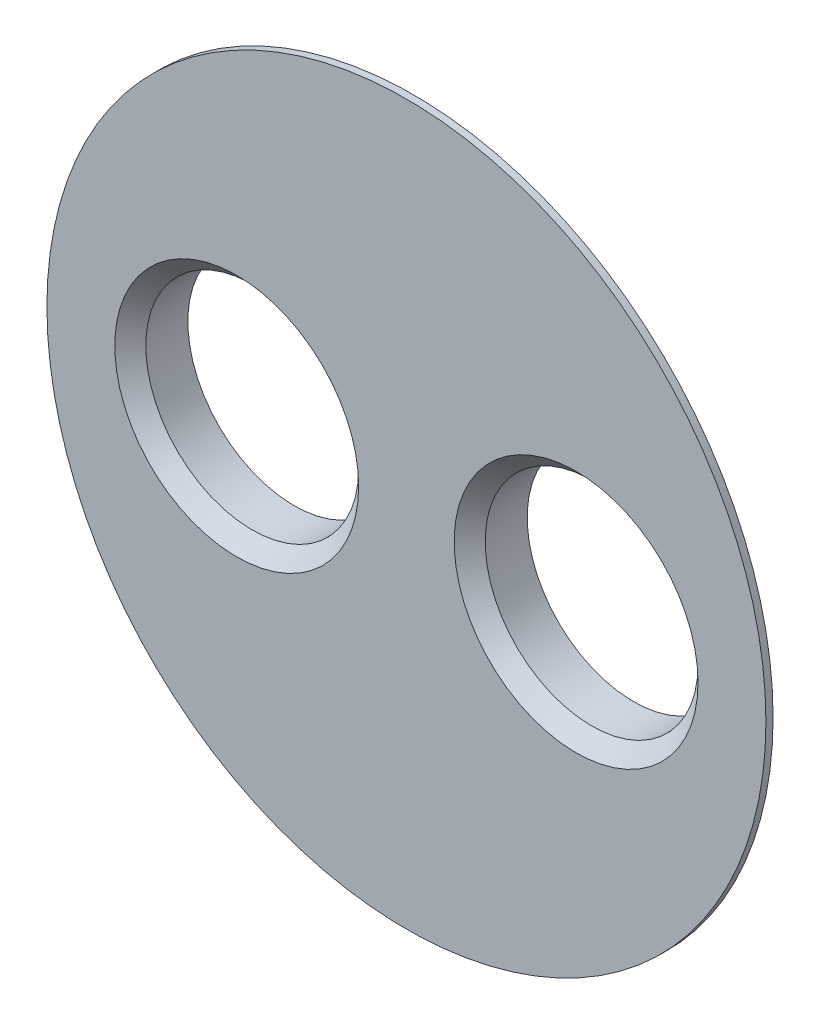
SolidWorks part; units mm, degrees
other "Marquage1"
sketch "Esquisse3" plane through (-62.5, 62.5, 0) normal (-0.5461, 0.8269, -0.1341) x (-0.7827, -0.4466, 0.4334)
ref_plane "Plan de face" through (0, 0, 0) normal (0, 0, 1) x (1, 0, 0)
ref_plane "Plan de dessus" through (0, 0, 0) normal (0, 1, 0) x (1, 0, 0)
ref_plane "Plan de droite" through (0, 0, 0) normal (1, 0, 0) x (0, 0, -1)
sketch "Esquisse1" plane through (0, 0, 0) normal (0, 0, 1) x (1, 0, 0)
  circle A0 centre (0, 0) radius 62.5
  dimension "D1" = 125
extrude "Boss.-Extru.1" add sketch "Esquisse1" along normal blind 10
sketch "Esquisse2" plane through (0, 0, 10) normal (0, 0, 1) x (1, 0, 0)
  circle A0 centre (-29.5, 0) radius 18.5
  circle A1 centre (29.5, 0) radius 18.5
  dimension "D3" = 37
  dimension "D4" = 37
  dimension "D1" = 29.5
  dimension "D2" = 29.5
extrude "Enlèv. mat.-Extru.1" cut sketch "Esquisse2" against normal blind 10
chamfer "Chanfrein1" distance 2.7 angle 45 2 edges at (-11, 0, 10) (48, 0, 10)
chamfer "Chanfrein2" distance 12.5 angle 35 1 edges at (62.5, 0, 0)
